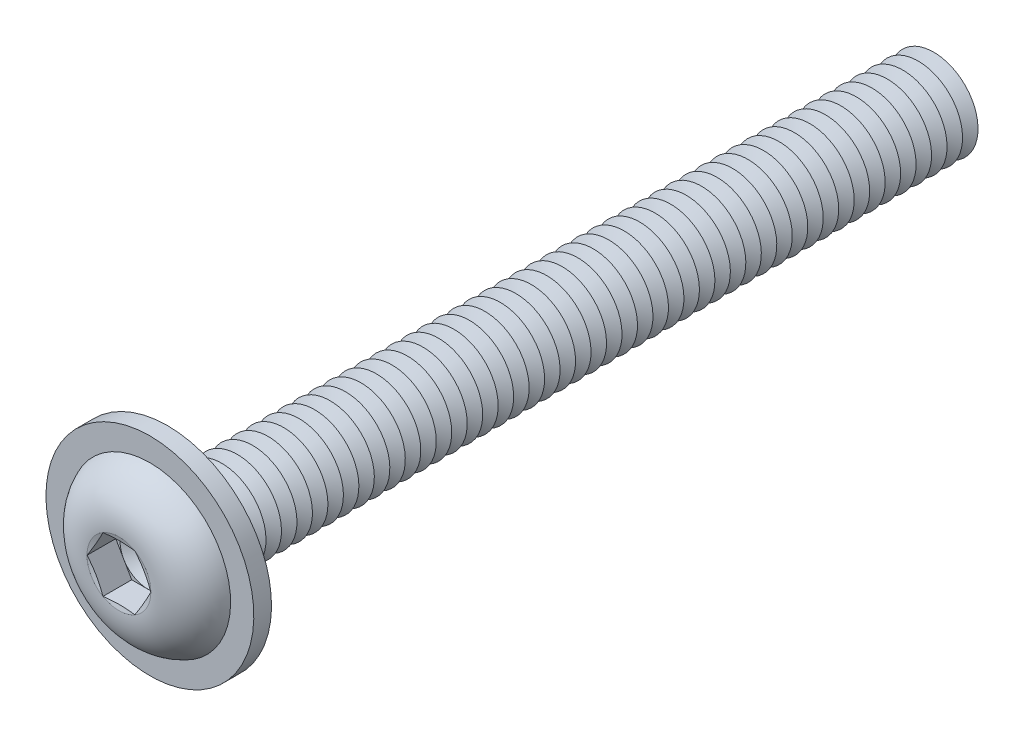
SolidWorks part; units mm, degrees
ref_plane "Front Plane" through (0, 0, 0) normal (0, 0, 1) x (1, 0, 0)
ref_plane "Top Plane" through (0, 0, 0) normal (0, 1, 0) x (1, 0, 0)
ref_plane "Right Plane" through (0, 0, 0) normal (1, 0, 0) x (0, 0, -1)
sketch "Sketch1" plane through (0, 0, 0) normal (1, 0, 0) x (0, 0, -1)
  line L0 (0, 2) -> (0, 3.8)
  line L3 (0, 2) -> (35, 2)
  line L4 (35, 2) -> (35, 0)
  line L5 (35, 0) -> (-2.2, 0) construction
  line L6 (-2.2, 0) -> (35, 0)
  line L7 (-2.2, 1.4434) -> (-2.2, 0.7217) construction
  line L8 (-2.2, 0.7217) -> (-2.2, 0)
  line L9 (-2.2, 1.4434) -> (-2.0066, 0.7217)
  line L10 (-2.0066, 0.7217) -> (-2.2, 0.7217)
  line L11 (35, 0) -> (22.7481, 0) construction
  line L12 (0, 3.8) -> (-2.2, 3.8) construction
  arc A1 (0, 3.8) -> (-2.2, 1.4434) centre (0, 1.5948) ccw
  point P8 (35, 1)
  dimension "D1" = 7.6
  dimension "D2" = 4
  dimension "D3" = 2.2
  dimension "D4" = 2.8868
  dimension "D5" = 35
  dimension "D6" = 15
revolve "Revolve1" add sketch "Sketch1" angle 360 about L5
fillet "Fillet1" radius 0.35 1 edges at (0, 2, 0)
sketch "Sketch2" plane through (0, 0, 0) normal (1, 0, 0) x (0, 0, -1)
  line L0 (34.65, 2) -> (35.35, 2)
  line L1 (35, 2) -> (0.35, 2) construction
  line L2 (35.35, 2) -> (35, 1.3938)
  line L3 (35, -2) -> (35, 2) construction
  line L4 (35, 1.3938) -> (34.65, 2)
  dimension "D1" = 0.7
revolve "Cut-Revolve1" cut sketch "Sketch2" angle 360 about axis through (0, 0, -35) along (0, 0, -1)
pattern_linear "LPattern1" count 50 spacing 0.7 along (0, 0, 1) of "Cut-Revolve1"
sketch "Sketch3" plane through (0, 0, 2.2) normal (0, 0, 1) x (1, 0, 0)
  line L7 (0.7217, 1.25) -> (-0.7217, 1.25)
  line L8 (-0.7217, 1.25) -> (-1.4434, 0)
  line L9 (-1.4434, 0) -> (-0.7217, -1.25)
  line L10 (-0.7217, -1.25) -> (0.7217, -1.25)
  line L11 (0.7217, -1.25) -> (1.4434, 0)
  line L12 (1.4434, 0) -> (0.7217, 1.25)
  circle A0 centre (0, 0) radius 1.25 construction
  circle A3 centre (0, 0) radius 1.4434 construction
extrude "Cut-Extrude1" cut sketch "Sketch3" against normal blind 1.3
sketch "Sketch4" plane through (0, 0, 0.9) normal (0, 0, 1) x (1, 0, 0)
  line L1 (0.7217, 1.25) -> (-0.7217, 1.25) construction
  circle A0 centre (0, 0) radius 1.25
extrude "Cut-Extrude2" cut sketch "Sketch4" against normal through all draft 60
sketch "Sketch5" plane through (0, 0, 0) normal (0, 0, -1) x (-1, 0, 0)
  circle A0 centre (0, 0) radius 4.7
  circle A1 centre (0, 0) radius 2.35
  circle A2 centre (0, 0) radius 2.35 construction
  dimension "D1" = 9.4
extrude "Boss-Extrude1" add sketch "Sketch5" against normal blind 0.8
